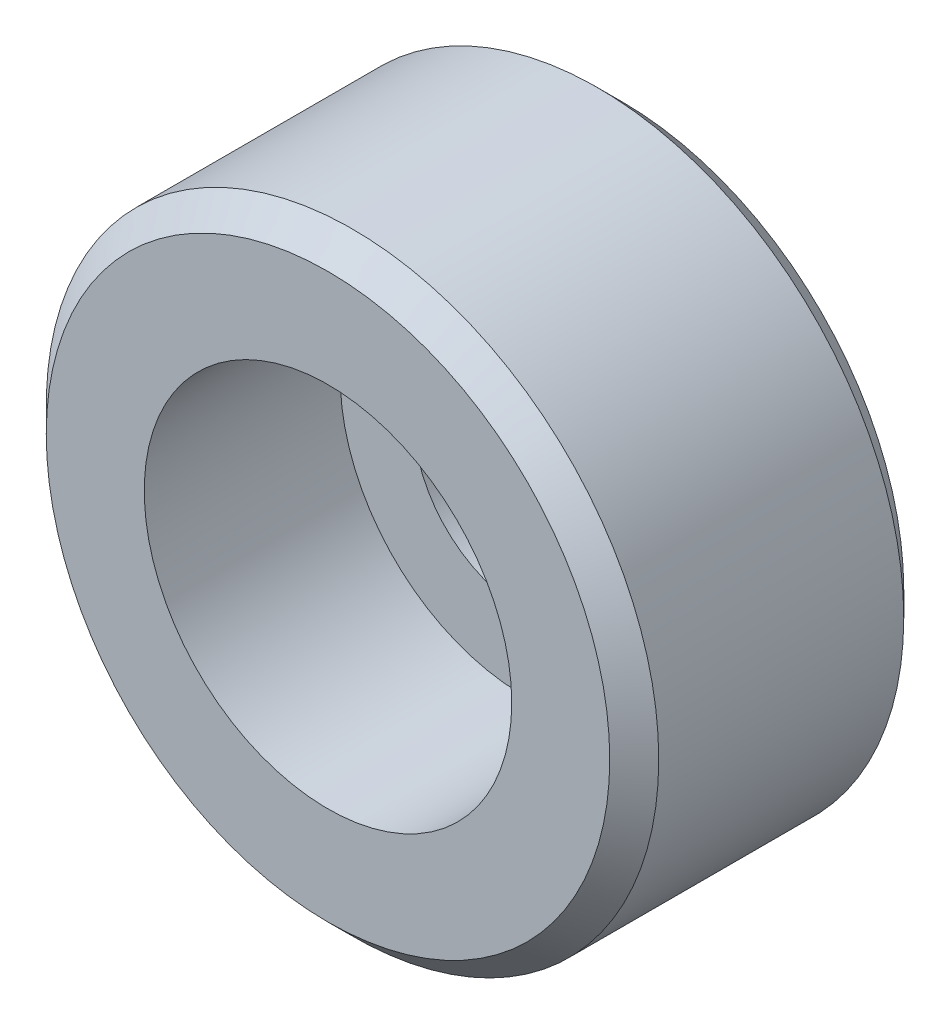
SolidWorks part; units mm, degrees
ref_plane "前基準面" through (0, 0, 0) normal (0, 0, 1) x (1, 0, 0)
ref_plane "上基準面" through (0, 0, 0) normal (0, 1, 0) x (1, 0, 0)
ref_plane "右基準面" through (0, 0, 0) normal (1, 0, 0) x (0, 0, -1)
sketch "草圖1" plane through (0, 0, 0) normal (0, 0, 1) x (1, 0, 0)
  circle A0 centre (0, 0) radius 12.5
  dimension "D2" = 25
extrude "填料-伸長1" add sketch "草圖1" along normal blind 12
hole_wizard "M8 六角承窩頭蓋螺釘的柱孔1" positions "草圖3" profile "草圖2" counterbore size "M8" standard "ISO"
sketch "草圖3" plane through (0, 0, 12) normal (0, 0, 1) x (1, 0, 0)
  point P0 (0, 0)
sketch "草圖2" plane through (0, 0, 12) normal (1, 0, 0) x (0, -1, 0)
  line L0 (0, 0) -> (0, 12)
  line L1 (0, 12) -> (4.5, 12)
  line L3 (4.5, 12) -> (4.5, 8)
  line L4 (4.5, 8) -> (7.5, 8)
  line L5 (7.5, 8) -> (7.5, 0)
  line L7 (7.5, 0) -> (0, 0)
  line L11 (0, -6.35) -> (0, 107.95) construction
  dimension "貫穿孔直徑" = 9
  dimension "貫穿孔深度" = 12
  dimension "柱孔直徑" = 15
  dimension "柱孔深度" = 8
chamfer "導角1" distance 1 angle 45 2 edges at (12.5, 0, 12) (12.5, 0, 0)
